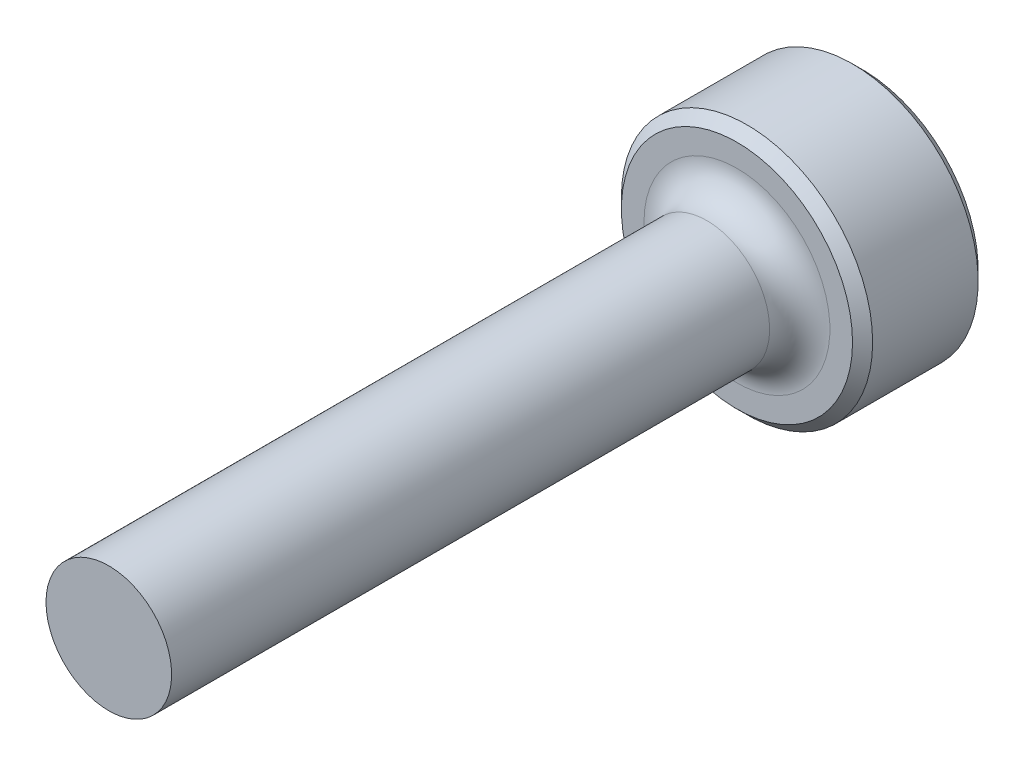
SolidWorks part; units mm, degrees
ref_plane "Front Plane" through (0, 0, 0) normal (0, 0, 1) x (1, 0, 0)
ref_plane "Top Plane" through (0, 0, 0) normal (0, 1, 0) x (1, 0, 0)
ref_plane "Right Plane" through (0, 0, 0) normal (1, 0, 0) x (0, 0, -1)
sketch "Sketch1" plane through (0, 0, 0) normal (1, 0, 0) x (0, 0, -1)
  line L0 (0, 0) -> (0, 3.175)
  line L1 (0, 3.175) -> (-3.175, 3.175)
  line L2 (-3.175, 3.175) -> (-3.175, 2.3495)
  line L3 (-3.937, 1.5875) -> (-19.05, 1.5875)
  line L4 (-19.05, 1.5875) -> (-19.05, 0)
  line L5 (-19.05, 0) -> (0, 0)
  line L6 (25.4347, 0) -> (-130.6739, 0) construction
  arc A0 (-3.175, 2.3495) -> (-3.937, 1.5875) centre (-3.937, 2.3495) cw
  dimension "D4" = 0.762
  dimension "D1" = 3.175
  dimension "D2" = 6.35
  dimension "D3" = 3.175
  dimension "D5" = 19.05
revolve "Revolve1" add sketch "Sketch1" angle 360 about L6
chamfer "Chamfer1" distance 0.254 angle 45 2 edges at (-3.175, 0, 0) (-3.175, 0, 3.175)
